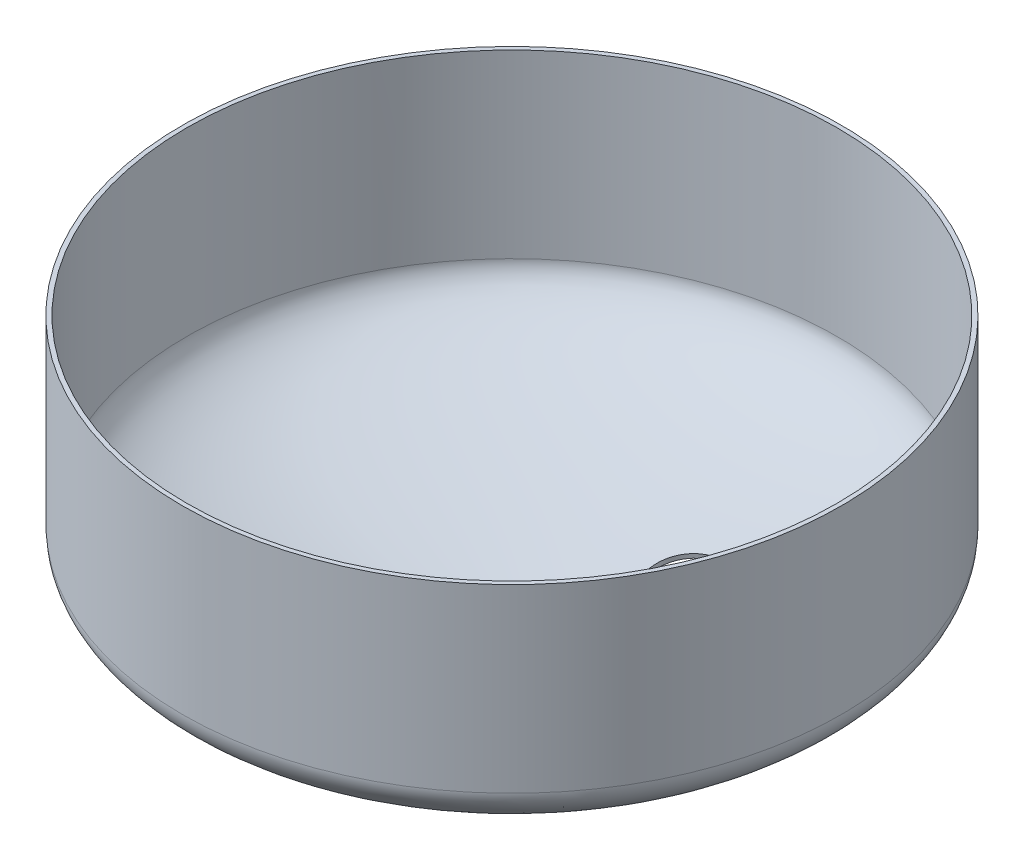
SolidWorks part; units mm, degrees
ref_plane "Vorne" through (0, 0, 0) normal (0, 0, 1) x (1, 0, 0)
ref_plane "Oben" through (0, 0, 0) normal (0, 1, 0) x (1, 0, 0)
ref_plane "Rechts" through (0, 0, 0) normal (1, 0, 0) x (0, 0, -1)
sketch "Skizze1" plane through (0, 0, 0) normal (1, 0, 0) x (0, 0, -1)
  line L0 (0, 182.5319) -> (0, -33.248) construction
  line L1 (190, 165) -> (0, 165)
  line L2 (0, 165) -> (0, 0)
  line L3 (0, 0) -> (30, 0)
  line L5 (190, 165) -> (190, 60.7998)
  ellipse E2 centre (-187.7804, 60.7998) end of major axis (190, 60.7998) minor radius 74.4079 (30, 0) -> (190, 60.7998) ccw
  dimension "D1" = 30
  dimension "D8" = 104.2002
  dimension "D2" = 165
  dimension "D3" = 380
revolve "Rotation1" add sketch "Skizze1" angle 360 about L0
shell "Wandung1" thickness 2.5
sketch "Skizze2" plane through (0, 0, 0) normal (0, -1, 0) x (1, 0, 0)
  circle A0 centre (0, 0) radius 9.25
  dimension "D1" = 18.5
extrude "Linear austragen1" cut sketch "Skizze2" against normal through all
sketch3d "3D-Skizze1"
  point P0 (30, 7.5641, -70)
  dimension "D1" = 70
  dimension "D2" = 30
ref_plane "Ebene1" through (30, 7.5641, -70) normal (0.0744, -0.982, -0.1736) x (0.9972, 0.0733, 0.013)
sketch "Skizze3" plane through (0.2611, -6.9562, -0.6093) normal (-0.0744, 0.982, 0.1736) x (0.9972, 0.0744, 0.0065)
  circle A0 centre (30.2839, 70.6625) radius 20
  dimension "D2" = 40
extrude "Linear austragen2" cut sketch "Skizze3" along normal blind 10
